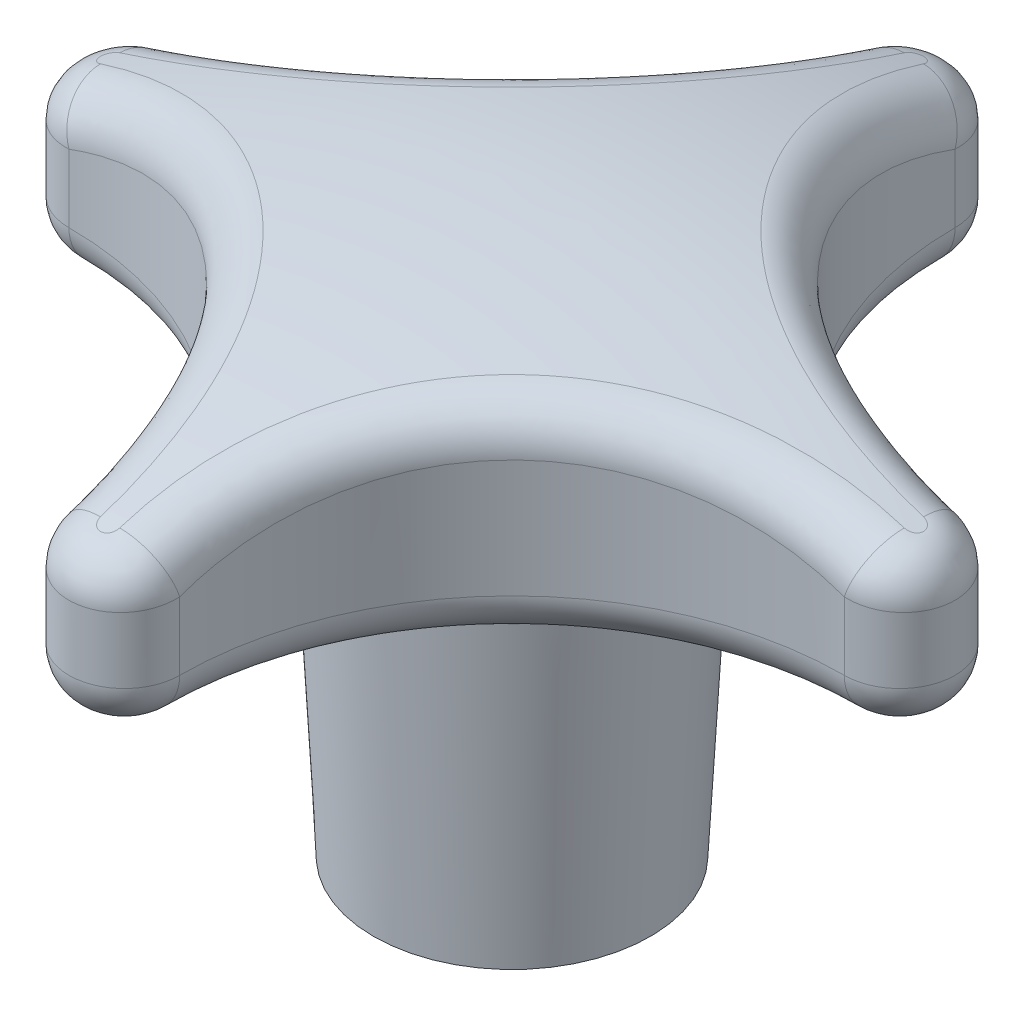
SolidWorks part; units mm, degrees
ref_plane "Front Plane" through (0, 0, 0) normal (0, 0, 1) x (1, 0, 0)
ref_plane "Top Plane" through (0, 0, 0) normal (0, 1, 0) x (1, 0, 0)
ref_plane "Right Plane" through (0, 0, 0) normal (1, 0, 0) x (0, 0, -1)
sketch "Sketch1" plane through (0, 0, 0) normal (0, 1, 0) x (1, 0, 0)
  circle A0 centre (0, 0) radius 12.5
  dimension "D1" = 25
extrude "Extrude1" add sketch "Sketch1" against normal blind 30
draft "Draft1" type of draft neutral plane draft angle 3 faces to draft 1 parameters "D1"=3
sketch "Sketch2" plane through (0, 0, 0) normal (0, 0, 1) x (1, 0, 0)
  line L0 (0, 0) -> (-40, 0)
  line L1 (-40, 0) -> (-40, 13)
  line L2 (0, 0) -> (0, 50000) construction
  line L3 (0, 20) -> (20.2547, 20) construction
  line L4 (0, 0) -> (0, 20)
  arc A0 (0, 20) -> (-40, 13) centre (0, -97.7857) ccw
revolve "Revolve1" add sketch "Sketch2" angle 360 about L2
sketch "Sketch4" plane through (0, 0, 0) normal (0, 1, 0) x (1, 0, 0)
  line L0 (0, 0) -> (-50000, 0) construction
  line L1 (0, 0) -> (0, 50000) construction
  line L2 (-35, 5) -> (-45.9117, 5) construction
  line L3 (-5, 35) -> (-5, 40.3224) construction
  arc A0 (0, 40) -> (-5, 35) centre (0, 35) ccw
  arc A1 (-35, 5) -> (-40, 0) centre (-35, 0) ccw
  circle A2 centre (0, 0) radius 40 construction
  arc A3 (-35, 5) -> (-5, 35) centre (-35, 35) ccw
  arc A4 (0, 40) -> (-40, 0) centre (-40, 40) ccw
  point P9 (0, 40)
  point P10 (-40, 0)
  point P13 (-5, 35)
  point P14 (-35, 5)
extrude "Extrude3" cut sketch "Sketch4" along normal through all
pattern_circular "CirPattern1" count 4 over 360 about axis through (0, 0, 0) along (0, 1, 0) of "Extrude3"
fillet "Fillet2" radius 4.1667 16 edges at (0, 0, 40) (13.7868, 0, 13.7868) (40, 0, 0) (13.7868, 0, -13.7868) (0, 0, -40) (-13.7868, 0, -13.7868) (-40, 0, 0) (-0.0002, 13, 40) (16.8148, 18.2601, 11.14) (40, 13, 0.0002) (11.14, 18.2601, -16.8148) (0.0002, 13, -40) (-16.8148, 18.2601, -11.14) (-40, 13, 0.0002) (-13.7868, 0, 13.7868) (-11.14, 18.2601, 16.8148)
fillet "Fillet3" radius 2.0833 1 edges at (0, 0, 14.0722)
sketch "Sketch6" plane through (0, -30, 0) normal (0, -1, 0) x (1, 0, 0)
  circle A0 centre (0, 0) radius 8
  dimension "D1" = 16
extrude "Extrude5" cut sketch "Sketch6" against normal blind 32
sketch "Sketch7" plane through (0, 0, 0) normal (0, 0, 1) x (1, 0, 0)
  line L0 (0, 2) -> (8, 2)
  line L1 (8, -30) -> (8, 2) construction
  line L2 (8, 2) -> (0, 6.6188)
  line L3 (0, 6.6188) -> (0, 2)
  line L4 (-8, -30) -> (8, -30) construction
revolve "Cut-Revolve1" cut sketch "Sketch7" angle 360 about L3
sketch "Sketch8" [suppressed] plane through (0, -24, 0) normal (0, -1, 0) x (1, 0, 0)
  circle A0 centre (0, 0) radius 6
  dimension "D1" = 8
extrude "Extrude6" [suppressed] cut sketch "Sketch8" against normal blind 38
sketch "Sketch9" [suppressed] plane through (0, -4, 0) normal (0, -1, 0) x (1, 0, 0)
  circle A0 centre (0, 0) radius 6.5
  dimension "D1" = 8.4
extrude "Extrude7" [suppressed] cut sketch "Sketch9" against normal through all
sketch "Sketch10" [suppressed] plane through (0, -24, 0) normal (0, -1, 0) x (1, 0, 0)
  circle A0 centre (0, 0) radius 6
extrude "Extrude8" [suppressed] cut sketch "Sketch10" against normal blind 28
sketch "Sketch11" [suppressed] plane through (0, 0, 0) normal (0, 0, 1) x (1, 0, 0)
  line L0 (5.1, 7.0555) -> (5.1, -2)
  line L1 (0, 0) -> (0, -5.4531) construction
  line L2 (5.1, 7.0555) -> (0, 10)
  line L3 (0, 10) -> (0, -2)
  line L4 (-6, -2) -> (6, -2) construction
  line L5 (5.1, -2) -> (0, -2)
revolve "Cut-Revolve2" [suppressed] cut sketch "Sketch11" angle 360 about L3
equation "\"D2@Sketch2\" = \"D1@Sketch2\"*.65"
equation "\"D1@Sketch4\" = (\"D3@Sketch2\"*2)/8"
equation "\"D2@Sketch4\" =( \"D3@Sketch2\"*2)/8"
equation "\"D1@Sketch7\" = \"D1@Extrude5\""
equation "\"D1@Fillet3\" = \"D1@Fillet2\"/2"
equation "\"D2@Sketch11\" = \"D1@Sketch10\""
